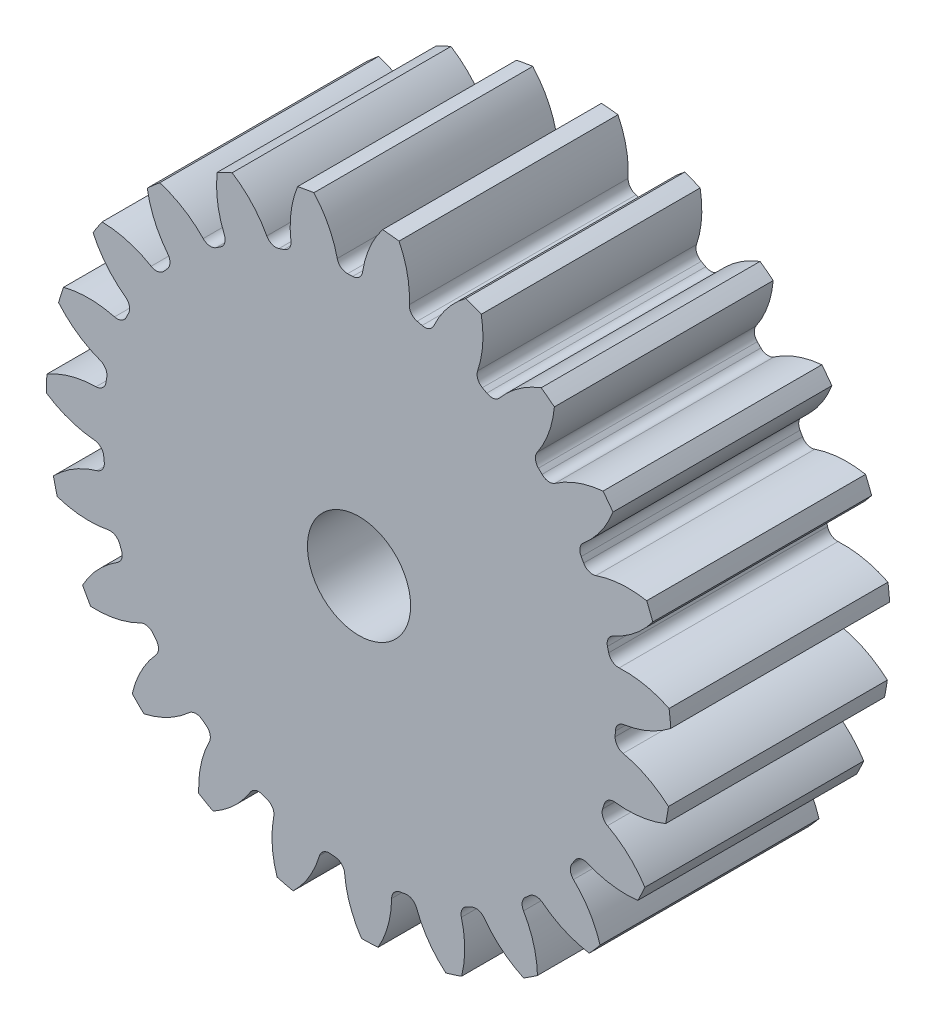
SolidWorks part; units mm, degrees
ref_plane "Front" through (0, 0, 0) normal (0, 0, 1) x (1, 0, 0)
ref_plane "Top" through (0, 0, 0) normal (0, 1, 0) x (1, 0, 0)
ref_plane "Right" through (0, 0, 0) normal (1, 0, 0) x (0, 0, -1)
sketch "Sketch3" plane through (0, 0, 0) normal (0, 0, 1) x (1, 0, 0)
  circle A0 centre (0, 0) radius 127
  dimension "od" = 254
extrude "gearBody" add sketch "Sketch3" along normal blind 88.9
sketch "Sketch2" plane through (0, 0, 0) normal (0, 0, 1) x (1, 0, 0)
  line L0 (0, 0) -> (101.4361, 42.0162) construction
  line L1 (126.0368, -18.5319) -> (0, 0) construction
  line L2 (0, 0) -> (36.3143, 0) construction
  line L3 (116.7711, 4.0119) -> (116.2343, -11.8819) construction
  line L5 (116.5027, -3.935) -> (0, 0) construction
  line L7 (0, 0) -> (109.7937, 0) construction
  arc A0 (109.7774, 1.8925) -> (109.3995, -9.2954) centre (0, 0) ccw construction
  arc A1 (126.6296, 9.6931) -> (125.6869, -18.2153) centre (0, 0) ccw construction
  arc A2 (116.7711, 4.0119) -> (116.2343, -11.8819) centre (0, 0) ccw construction
  arc A3 (104.0408, -4.5453) -> (104.1103, -2.4852) centre (0, 0) ccw
  arc A4 (126.0368, -18.5319) -> (107.2735, -8.7622) centre (98.3699, -48.7649) ccw
  arc A5 (126.0368, -18.5319) -> (127, 9.9853) centre (0, 0) ccw
  arc A6 (127, 9.9853) -> (107.6203, 1.5039) centre (101.4361, 42.0162) cw
  arc A7 (104.1103, -2.4852) -> (107.6203, 1.5039) centre (108.2443, -2.5839) cw
  arc A8 (107.2735, -8.7622) -> (104.0408, -4.5453) centre (108.1719, -4.7258) cw
  point P6 (127, 9.9853)
  point P22 (126.0368, -18.5319)
  dimension "baseDia" = 219.5874
  dimension "od" = 254
  dimension "pd" = 233.68
  dimension "rd" = 208.28
  dimension "rFillet" = 4.1351
  dimension "pointX" = 127
  dimension "pointY" = 9.9853
  dimension "CTT" = 15.8937
  dimension "flankCenterAngle" = 22.5
extrude "toothCut" cut sketch "Sketch2" along normal through all
pattern_circular "CirPattern1" count 23 over 360 about axis through (0, 0, 0) along (0, 0, 1) of "toothCut"
sketch "hub1Dia" plane through (0, 0, 0) normal (0, 0, -1) x (-1, 0, 0)
  circle A0 centre (0, 0) radius 12.7
  dimension "hub1Dia" = 25.4
sketch "hub2Dia" plane through (0, 0, 88.9) normal (0, 0, 1) x (1, 0, 0)
  circle A0 centre (0, 0) radius 12.7
  dimension "hub2dia" = 25.4
sketch "boreDia" plane through (0, 0, 0) normal (0, 0, 1) x (1, 0, 0)
  circle A0 centre (0, 0) radius 20.955
  dimension "boreDia" = 41.91
extrude "bore" cut sketch "boreDia" against normal mid plane 25400
